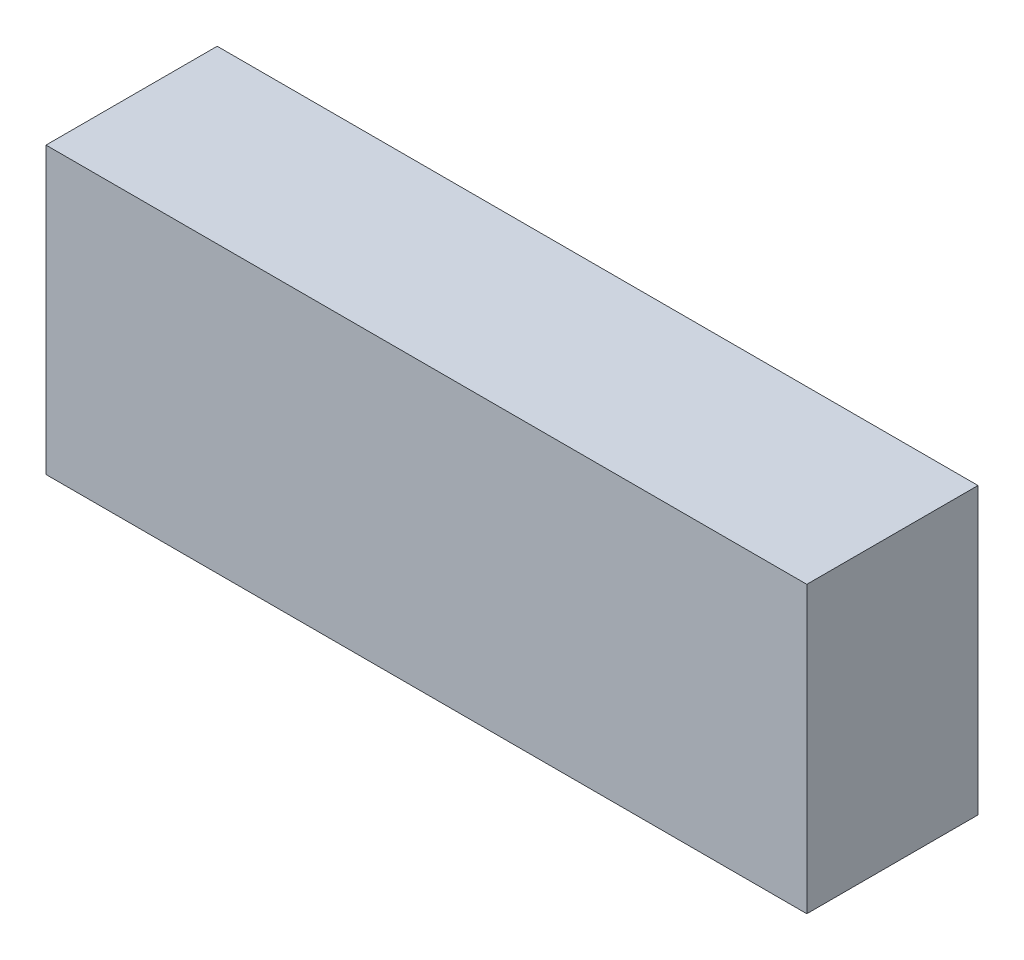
SolidWorks part; units mm, degrees
ref_plane "Front" through (0, 0, 0) normal (0, 0, 1) x (1, 0, 0)
ref_plane "Top" through (0, 0, 0) normal (0, 1, 0) x (1, 0, 0)
ref_plane "Right" through (0, 0, 0) normal (1, 0, 0) x (0, 0, -1)
sketch "Sketch1" plane through (0, 0, 0) normal (0, 0, 1) x (1, 0, 0)
  line L1 (103.7577, -108.7459) -> (903.7577, -108.7459)
  line L2 (103.7577, -108.7459) -> (103.7577, -408.7459)
  line L3 (103.7577, -408.7459) -> (903.7577, -408.7459)
  line L4 (903.7577, -108.7459) -> (903.7577, -408.7459)
  dimension "D1" = 300
  dimension "D2" = 800
extrude "Boss-Extrude1" add sketch "Sketch1" along normal blind 180
